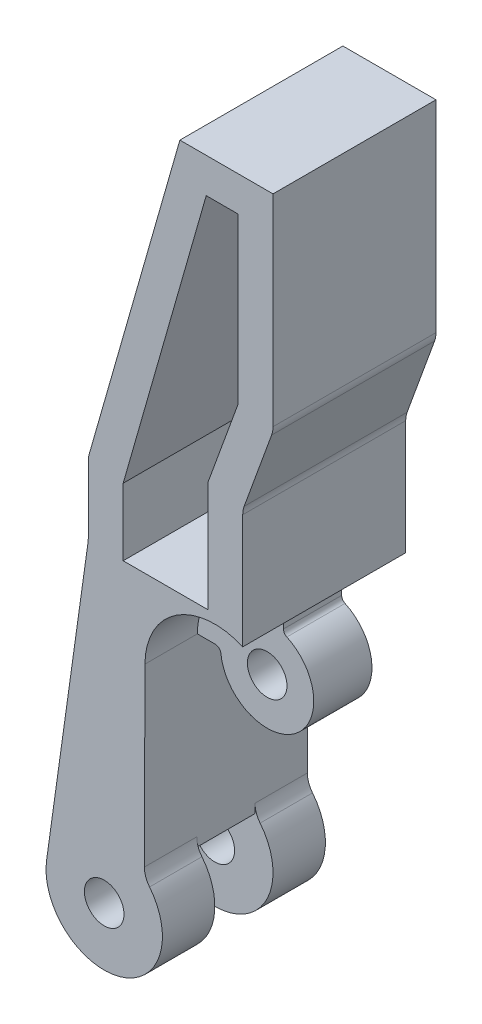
SolidWorks part; units mm, degrees
ref_plane "Front Plane" through (0, 0, 0) normal (0, 0, 1) x (1, 0, 0)
ref_plane "Top Plane" through (0, 0, 0) normal (0, 1, 0) x (1, 0, 0)
ref_plane "Right Plane" through (0, 0, 0) normal (1, 0, 0) x (0, 0, -1)
sketch "Sketch1" plane through (0, 0, 0) normal (0, 0, 1) x (1, 0, 0)
  line L0 (6.5, 60) -> (14.5, 60)
  line L1 (14.5, 60) -> (14.5, 42.3255)
  line L2 (14.5, 42.3255) -> (11.8979, 35.1811)
  line L3 (11.8979, 35.1811) -> (11.8979, 25)
  line L4 (6.5, 60) -> (-1.37, 32.4617)
  line L5 (-1.37, 32.4617) -> (-1.37, 26.2706)
  line L6 (-1.37, 26.2706) -> (-4.9517, 0.6934)
  line L7 (3.4491, 3.6199) -> (3.5, 19.5192)
  circle A0 centre (0, 0) radius 5
  arc A1 (11.8979, 25) -> (3.5, 19.5192) centre (9.5, 19.5) ccw
  dimension "D1" = 10
  dimension "D5" = 6
  dimension "D2" = 65
  dimension "D3" = 8
  dimension "D4" = 35
  dimension "D6" = 14.5
  dimension "D7" = 5
  dimension "D8" = 19.5
extrude "Boss-Extrude1" add sketch "Sketch1" along normal mid plane 14
sketch "Sketch2" plane through (0, 0, 7) normal (0, 0, 1) x (1, 0, 0)
  line L24 (1.63, 26.2706) -> (8.8979, 26.2706)
  line L30 (8.8979, 35.7104) -> (8.8979, 25)
  line L31 (1.63, 26.2706) -> (1.63, 32.0415)
  line L32 (11.5, 42.8548) -> (8.8979, 35.7104)
  line L33 (11.5, 57) -> (11.5, 42.8548)
  line L34 (8.7628, 57) -> (11.5, 57)
  line L35 (1.63, 32.0415) -> (8.7628, 57)
  line L36 (8.8979, 35.7104) -> (8.8979, 26.2706)
  line L37 (1.63, 26.2706) -> (1.63, 32.0415)
  line L38 (11.5, 42.8548) -> (8.8979, 35.7104)
  line L39 (11.5, 57) -> (11.5, 42.8548)
  line L40 (8.7628, 57) -> (11.5, 57)
  line L41 (1.63, 32.0415) -> (8.7628, 57)
  dimension "D1" = 3
extrude "Cut-Extrude1" cut sketch "Sketch2" against normal through all and the other way through all
sketch "Sketch3" plane through (0, 0, 0) normal (0, 0, 1) x (1, 0, 0)
  line L0 (3.5, 19.5192) -> (5.0258, 19.5192)
  line L1 (10.8979, 25.3349) -> (10.8979, 23.5802)
  line L2 (11.8979, 35.1811) -> (11.8979, 25) construction
  arc A0 (11.8979, 25) -> (3.5, 19.5192) centre (9.5, 19.5) ccw construction
  arc A1 (10.8979, 25.3349) -> (3.5, 19.5192) centre (9.5, 19.5) ccw
  arc A2 (5.5229, 19.0726) -> (11.187, 23.1268) centre (9.5, 19.5) ccw
  arc A3 (10.8979, 23.5802) -> (11.187, 23.1268) centre (11.3979, 23.5802) ccw
  arc A4 (5.0258, 19.5192) -> (5.5229, 19.0726) centre (5.0258, 19.0192) cw
  dimension "D1" = 8
  dimension "D3" = 0.5
  dimension "D2" = 1
extrude "Boss-Extrude2" add sketch "Sketch3" along normal mid plane 5
sketch "Sketch4" plane through (0, 0, 0) normal (0, 0, 1) x (1, 0, 0)
  circle A0 centre (0, 0) radius 5
  arc A1 (-4.9517, 0.6934) -> (3.4491, 3.6199) centre (0, 0) ccw construction
extrude "Cut-Extrude2" cut sketch "Sketch4" against normal mid plane 5
hole_wizard "M3 Clearance Hole1" positions "Sketch5" profile "Sketch6" hole size "M3" standard "ISO"
sketch "Sketch5" plane through (0, 0, 7) normal (0, 0, 1) x (1, 0, 0)
  point P0 (9.5, 19.5)
  point P4 (0, 0)
sketch "Sketch6" plane through (9.5, 19.5, 7) normal (1, 0, 0) x (0, -1, 0)
  line L0 (0, 0) -> (0, 14)
  line L1 (0, 14) -> (1.7, 14)
  line L2 (1.7, 14) -> (1.7, 0)
  line L5 (1.7, 0) -> (0, 0)
  line L11 (0, -6.35) -> (0, 107.95) construction
  dimension "Thru Hole Dia." = 3.4
  dimension "Thru Hole Depth" = 14
hole_wizard "CSK for M3 Hex Socket Countersunk Cap Screw1" positions "Sketch7" profile "Sketch8" countersink size "M3" standard "ISO"
sketch "Sketch7" plane through (0, 0, -7) normal (0, 0, 1) x (1, 0, 0)
  point P0 (0, 0)
sketch "Sketch8" plane through (0, 0, -7) normal (1, 0, 0) x (0, 1, 0)
  line L0 (0, 0) -> (0, 14.0001)
  line L1 (0, 14.0001) -> (1.7, 14.0001)
  line L2 (1.7, 14.0001) -> (1.7, 1.66)
  line L3 (1.7, 1.66) -> (3.36, 0)
  line L5 (3.36, 0) -> (0, 0)
  line L6 (-1.7, 1.66) -> (-3.36, 0) construction
  line L11 (0, -6.35) -> (0, 107.95) construction
  dimension "Thru Hole Dia." = 3.4
  dimension "Thru Hole Depth" = 14.0001
  dimension "Near C'Sink Dia." = 6.72
  dimension "Near C'Sink Angle" = 90
fillet "Fillet1" radius 2 6 edges at (3.4491, 3.6199, -4.75) (3.4491, 3.6199, 4.75) (-1.37, 26.2706, 0) (-1.37, 32.4617, 0) (14.5, 42.3255, 0) (11.8979, 35.1811, 0)
